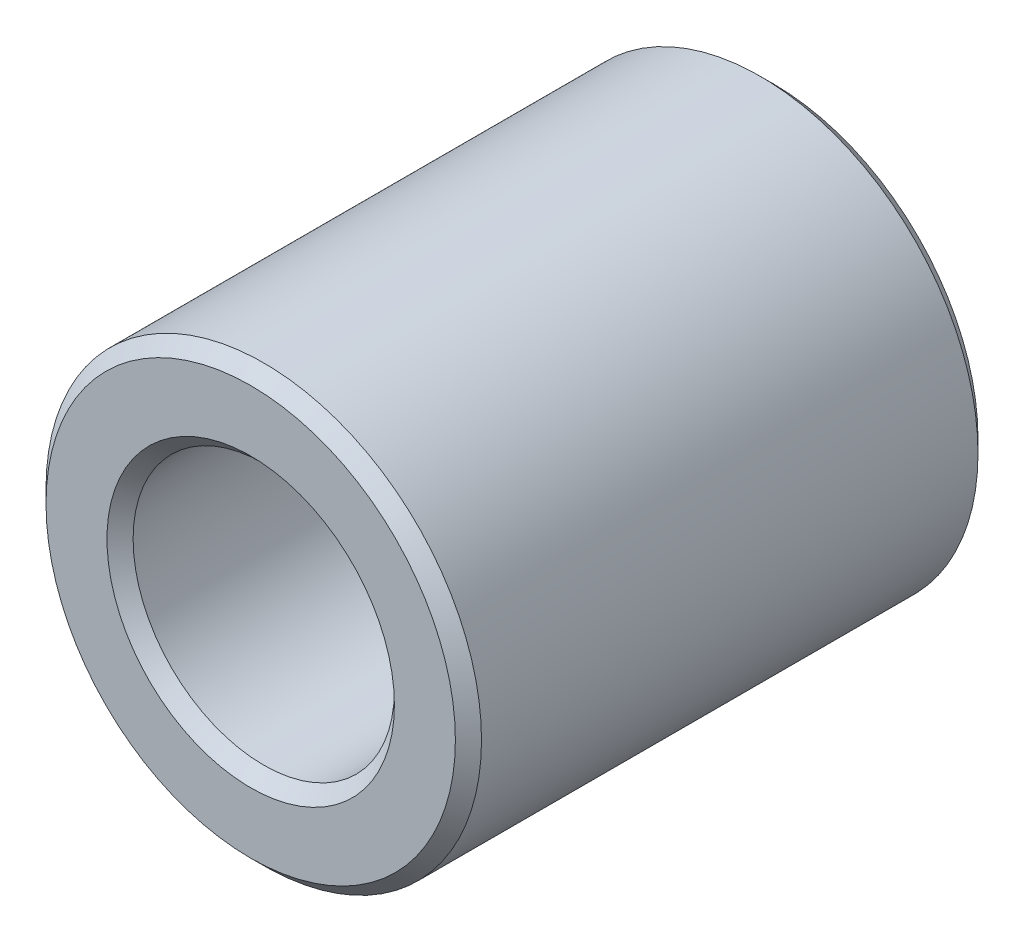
SolidWorks part; units mm, degrees
ref_plane "Front Plane" through (0, 0, 0) normal (0, 0, 1) x (1, 0, 0)
ref_plane "Top Plane" through (0, 0, 0) normal (0, 1, 0) x (1, 0, 0)
ref_plane "Right Plane" through (0, 0, 0) normal (1, 0, 0) x (0, 0, -1)
sketch "Sketch1" plane through (0, 0, 0) normal (0, 0, 1) x (1, 0, 0)
  circle A0 centre (0, 0) radius 30
  circle A1 centre (0, 0) radius 50
  dimension "D1" = 60
  dimension "D2" = 100
extrude "Boss-Extrude1" add sketch "Sketch1" along normal mid plane 120
chamfer "Chamfer1" distance 3 angle 45 4 edges at (30, 0, -60) (50, 0, -60) (30, 0, 60) (50, 0, 60)
